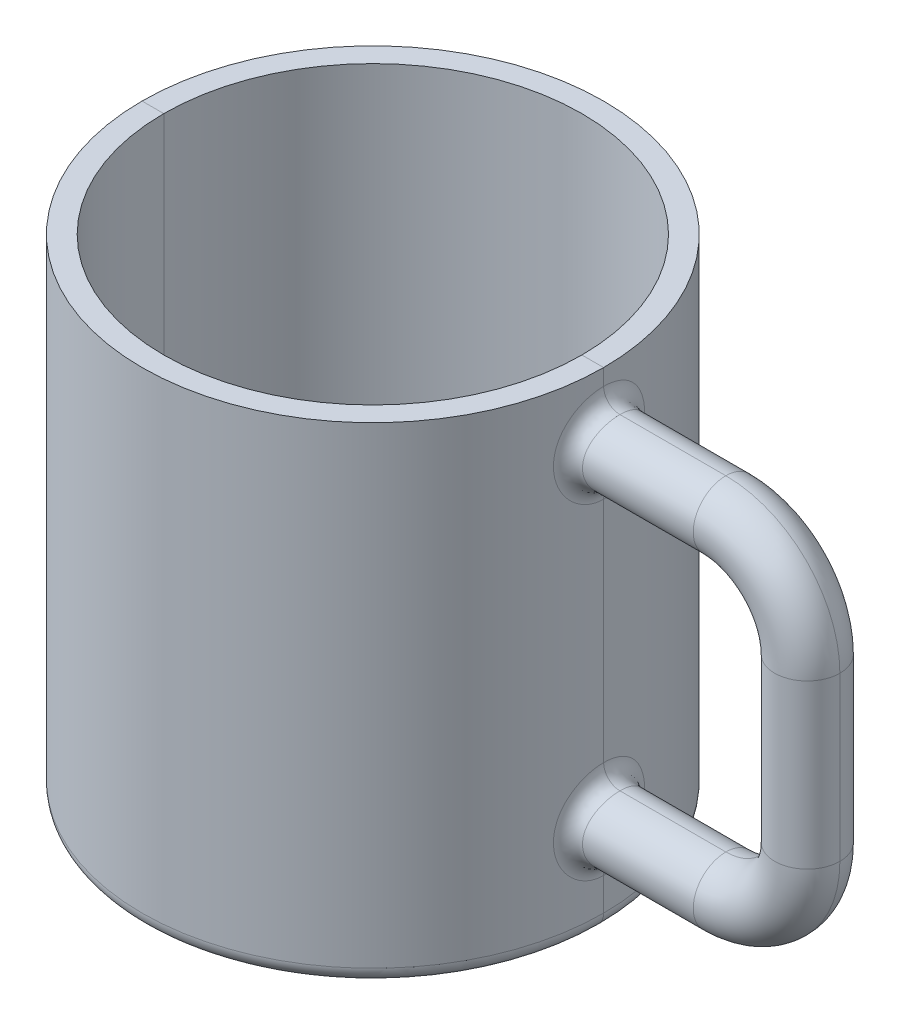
SolidWorks part; units mm, degrees
ref_plane "Front Plane" through (0, 0, 0) normal (0, 0, 1) x (1, 0, 0)
ref_plane "Top Plane" through (0, 0, 0) normal (0, 1, 0) x (1, 0, 0)
ref_plane "Right Plane" through (0, 0, 0) normal (1, 0, 0) x (0, 0, -1)
sketch "Sketch1" plane through (0, 0, 0) normal (0, 1, 0) x (1, 0, 0)
  circle A0 centre (0, 0) radius 42.5
  dimension "D1" = 85
extrude "Extrude1" add sketch "Sketch1" along normal blind 90
fillet "Fillet1" radius 3 1 edges at (0, 0, 42.5)
shell "Shell1" thickness 4
fillet "Fillet2" radius 3 1 edges at (0, 4, 38.5)
sketch "Sketch2" plane through (0, 0, 0) normal (0, 0, 1) x (1, 0, 0)
  line L0 (0, 0) -> (0, 99.6851) construction
  line L2 (55, 78) -> (65, 78)
  line L4 (55, 18) -> (65, 18)
  line L5 (80, 63) -> (80, 33)
  line L6 (42.5, 90) -> (-42.5, 90) construction
  arc A0 (80, 63) -> (65, 78) centre (65, 63) ccw
  arc A1 (65, 18) -> (80, 33) centre (65, 33) ccw
  point P13 (80, 78)
  point P16 (80, 18)
  dimension "D4" = 15
  dimension "D1" = 80
  dimension "D2" = 12
  dimension "D3" = 60
  dimension "D6" = 55
ref_plane "Plane1" through (55, 0, 0) normal (1, 0, 0) x (0, 0, -1)
sketch "Sketch3" plane through (55, 0, 0) normal (1, 0, 0) x (0, 0, -1)
  circle A0 centre (0, 78) radius 6
  dimension "D1" = 12
sweep "Sweep1" add profiles "Sketch3" path "Sketch2"
sketch "Sketch5" plane through (55, 0, 0) normal (-1, 0, 0) x (0, 0, 1)
  circle A1 centre (0, 78) radius 6
  circle A2 centre (0, 78) radius 6
  dimension "D1" = 0
extrude "Extrude5" add sketch "Sketch5" along normal up to surface (12.9257 mm away)
sketch "Sketch6" plane through (55, 0, 0) normal (-1, 0, 0) x (0, 0, 1)
  circle A1 centre (0, 18) radius 6
  circle A2 centre (0, 18) radius 6
  dimension "D1" = 0
extrude "Extrude6" add sketch "Sketch6" along normal up to surface (12.5 mm away)
fillet "Fillet3" radius 3 2 edges at (42.0948, 76.6868, 5.8545) (42.4797, 12.1454, -1.313)
sketch "Sketch8" plane through (0, 0, 0) normal (1, 0, 0) x (0, 0, -1)
  line L0 (0, 0) -> (0, 90)
  line L1 (38.5, 90) -> (-38.5, 90) construction
